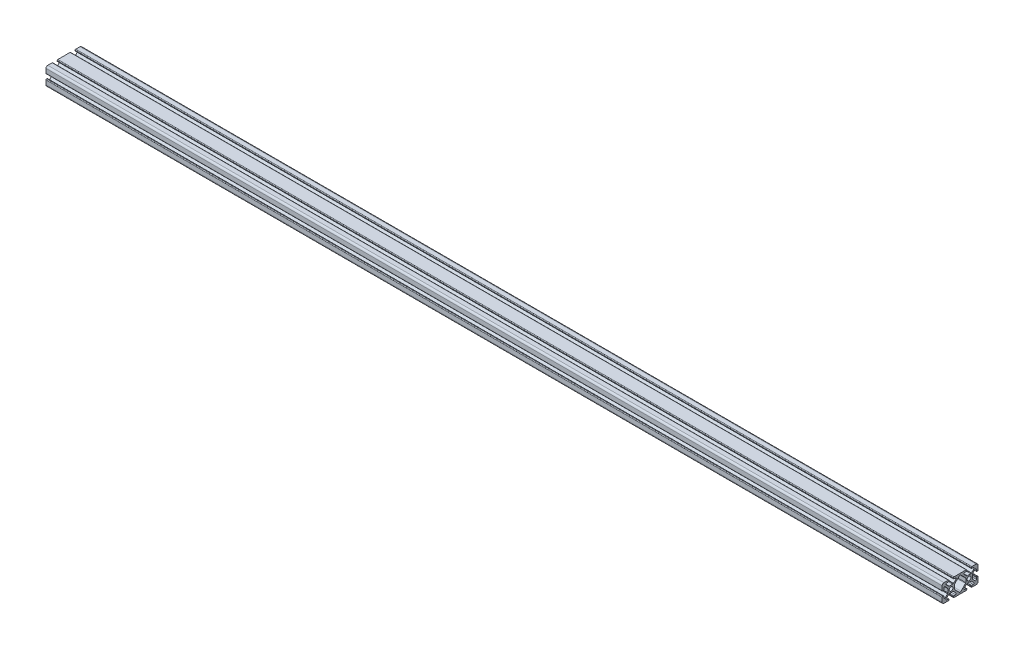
SolidWorks part; units mm, degrees
ref_plane "Ebene vorne" through (0, 0, 0) normal (0, 0, 1) x (1, 0, 0)
ref_plane "Ebene oben" through (0, 0, 0) normal (0, 1, 0) x (1, 0, 0)
ref_plane "Ebene rechts" through (0, 0, 0) normal (1, 0, 0) x (0, 0, -1)
sketch "Skizze1" plane through (0, 0, 0) normal (0, 1, 0) x (1, 0, 0)
  line L0 (0, 0) -> (1000, 0)
  dimension "D1" = 1000
other "Strukturbauteil1"
ref_plane "Ebene1" through (0, 0, 0) normal (1, 0, 0) x (0, 0, -1)
sketch "Model" plane through (0, 0, 0) normal (1, 0, 0) x (0, 0, -1)
  line L0 (-20, -3.2) -> (-20, -8)
  line L1 (-18, -10) -> (-13.2, -10)
  line L2 (-12.5, -9.3) -> (-12.5, -8.7)
  line L3 (-13, -8.2) -> (-14.8676, -8.2)
  line L4 (-15.4915, -6.6936) -> (-12.7408, -3.9429)
  line L5 (-12.0337, -3.65) -> (-7.9663, -3.65)
  line L6 (-7.2592, -3.9429) -> (-4.5085, -6.6936)
  line L7 (-5.1324, -8.2) -> (-7, -8.2)
  line L8 (-7.5, -8.7) -> (-7.5, -9.3)
  line L9 (-6.8, -10) -> (6.8, -10)
  line L10 (7.5, -9.3) -> (7.5, -8.7)
  line L11 (7, -8.2) -> (5.1324, -8.2)
  line L12 (4.5085, -6.6936) -> (7.2592, -3.9429)
  line L13 (7.9663, -3.65) -> (12.0337, -3.65)
  line L14 (12.7408, -3.9429) -> (15.4915, -6.6936)
  line L15 (14.8676, -8.2) -> (13, -8.2)
  line L16 (12.5, -8.7) -> (12.5, -9.3)
  line L17 (13.2, -10) -> (18, -10)
  line L18 (20, -8) -> (20, -3.2)
  line L19 (19.3, -2.5) -> (18.7, -2.5)
  line L20 (18.2, -3) -> (18.2, -4.8676)
  line L21 (16.6936, -5.4915) -> (13.9429, -2.7408)
  line L22 (13.65, -2.0337) -> (13.65, 2.0337)
  line L23 (13.9429, 2.7408) -> (16.6936, 5.4915)
  line L24 (18.2, 4.8676) -> (18.2, 3)
  line L25 (18.7, 2.5) -> (19.3, 2.5)
  line L26 (20, 3.2) -> (20, 8)
  line L27 (18, 10) -> (13.2, 10)
  line L28 (12.5, 9.3) -> (12.5, 8.7)
  line L29 (13, 8.2) -> (14.8676, 8.2)
  line L30 (15.4915, 6.6936) -> (12.7408, 3.9429)
  line L31 (12.0337, 3.65) -> (7.9663, 3.65)
  line L32 (7.2592, 3.9429) -> (4.5085, 6.6936)
  line L33 (5.1324, 8.2) -> (7, 8.2)
  line L34 (7.5, 8.7) -> (7.5, 9.3)
  line L35 (6.8, 10) -> (-6.8, 10)
  line L36 (-7.5, 9.3) -> (-7.5, 8.7)
  line L37 (-7, 8.2) -> (-5.1324, 8.2)
  line L38 (-4.5085, 6.6936) -> (-7.2592, 3.9429)
  line L39 (-7.9663, 3.65) -> (-12.0337, 3.65)
  line L40 (-12.7408, 3.9429) -> (-15.4915, 6.6936)
  line L41 (-14.8676, 8.2) -> (-13, 8.2)
  line L42 (-12.5, 8.7) -> (-12.5, 9.3)
  line L43 (-13.2, 10) -> (-18, 10)
  line L44 (-20, 8) -> (-20, 3.2)
  line L45 (-19.3, 2.5) -> (-18.7, 2.5)
  line L46 (-18.2, 3) -> (-18.2, 4.8676)
  line L47 (-16.6936, 5.4915) -> (-13.9429, 2.7408)
  line L48 (-13.65, 2.0337) -> (-13.65, -2.0337)
  line L49 (-13.9429, -2.7408) -> (-16.6936, -5.4915)
  line L50 (-18.2, -4.8676) -> (-18.2, -3)
  line L51 (-18.7, -2.5) -> (-19.3, -2.5)
  line L52 (-6.35, -2.0337) -> (-6.35, 2.0337)
  line L53 (-6.0571, 2.7408) -> (-1.0207, 7.7772)
  line L54 (1.0207, 7.7772) -> (6.0571, 2.7408)
  line L55 (6.35, 2.0337) -> (6.35, -2.0337)
  line L56 (6.0571, -2.7408) -> (1.0207, -7.7772)
  line L57 (-1.0207, -7.7772) -> (-6.0571, -2.7408)
  line L58 (-12.7408, 3.9429) -> (-12.0337, 3.65)
  line L59 (-20, -10) -> (20, -10) construction
  line L60 (-20, -10) -> (-20, 10) construction
  line L61 (-20, 10) -> (20, 10) construction
  line L62 (20, -10) -> (20, 10) construction
  line L63 (-20, -10) -> (20, 10) construction
  line L64 (-20, 10) -> (20, -10) construction
  line L65 (-7.9663, 3.65) -> (-7.2592, 3.9429)
  line L66 (7.2592, 3.9429) -> (7.9663, 3.65)
  line L67 (12.0337, 3.65) -> (12.7408, 3.9429)
  line L68 (13.9429, 2.7408) -> (13.65, 2.0337)
  line L69 (13.65, -2.0337) -> (13.9429, -2.7408)
  line L70 (12.7408, -3.9429) -> (12.0337, -3.65)
  line L71 (7.9663, -3.65) -> (7.2592, -3.9429)
  line L72 (-7.2592, -3.9429) -> (-7.9663, -3.65)
  line L73 (-12.0337, -3.65) -> (-12.7408, -3.9429)
  line L74 (-13.9429, -2.7408) -> (-13.65, -2.0337)
  line L75 (-13.65, 2.0337) -> (-13.9429, 2.7408)
  circle A0 centre (-10, 0) radius 2.15
  circle A1 centre (10, 0) radius 2.15
  arc A2 (-20, -8) -> (-18, -10) centre (-18, -8) ccw
  arc A3 (-13.2, -10) -> (-12.5, -9.3) centre (-13.2, -9.3) ccw
  arc A4 (-12.5, -8.7) -> (-13, -8.2) centre (-13, -8.7) ccw
  arc A5 (-15.4915, -6.6936) -> (-14.8676, -8.2) centre (-14.8676, -7.3176) ccw
  arc A8 (-5.1324, -8.2) -> (-4.5085, -6.6936) centre (-5.1324, -7.3176) ccw
  arc A9 (-7, -8.2) -> (-7.5, -8.7) centre (-7, -8.7) ccw
  arc A10 (-7.5, -9.3) -> (-6.8, -10) centre (-6.8, -9.3) ccw
  arc A11 (6.8, -10) -> (7.5, -9.3) centre (6.8, -9.3) ccw
  arc A12 (7.5, -8.7) -> (7, -8.2) centre (7, -8.7) ccw
  arc A13 (4.5085, -6.6936) -> (5.1324, -8.2) centre (5.1324, -7.3176) ccw
  arc A16 (14.8676, -8.2) -> (15.4915, -6.6936) centre (14.8676, -7.3176) ccw
  arc A17 (13, -8.2) -> (12.5, -8.7) centre (13, -8.7) ccw
  arc A18 (12.5, -9.3) -> (13.2, -10) centre (13.2, -9.3) ccw
  arc A19 (18, -10) -> (20, -8) centre (18, -8) ccw
  arc A20 (20, -3.2) -> (19.3, -2.5) centre (19.3, -3.2) ccw
  arc A21 (18.7, -2.5) -> (18.2, -3) centre (18.7, -3) ccw
  arc A22 (16.6936, -5.4915) -> (18.2, -4.8676) centre (17.3176, -4.8676) ccw
  arc A25 (18.2, 4.8676) -> (16.6936, 5.4915) centre (17.3176, 4.8676) ccw
  arc A26 (18.2, 3) -> (18.7, 2.5) centre (18.7, 3) ccw
  arc A27 (19.3, 2.5) -> (20, 3.2) centre (19.3, 3.2) ccw
  arc A28 (20, 8) -> (18, 10) centre (18, 8) ccw
  arc A29 (13.2, 10) -> (12.5, 9.3) centre (13.2, 9.3) ccw
  arc A30 (12.5, 8.7) -> (13, 8.2) centre (13, 8.7) ccw
  arc A31 (15.4915, 6.6936) -> (14.8676, 8.2) centre (14.8676, 7.3176) ccw
  arc A34 (5.1324, 8.2) -> (4.5085, 6.6936) centre (5.1324, 7.3176) ccw
  arc A35 (7, 8.2) -> (7.5, 8.7) centre (7, 8.7) ccw
  arc A36 (7.5, 9.3) -> (6.8, 10) centre (6.8, 9.3) ccw
  arc A37 (-6.8, 10) -> (-7.5, 9.3) centre (-6.8, 9.3) ccw
  arc A38 (-7.5, 8.7) -> (-7, 8.2) centre (-7, 8.7) ccw
  arc A39 (-4.5085, 6.6936) -> (-5.1324, 8.2) centre (-5.1324, 7.3176) ccw
  arc A42 (-14.8676, 8.2) -> (-15.4915, 6.6936) centre (-14.8676, 7.3176) ccw
  arc A43 (-13, 8.2) -> (-12.5, 8.7) centre (-13, 8.7) ccw
  arc A44 (-12.5, 9.3) -> (-13.2, 10) centre (-13.2, 9.3) ccw
  arc A45 (-18, 10) -> (-20, 8) centre (-18, 8) ccw
  arc A46 (-20, 3.2) -> (-19.3, 2.5) centre (-19.3, 3.2) ccw
  arc A47 (-18.7, 2.5) -> (-18.2, 3) centre (-18.7, 3) ccw
  arc A48 (-16.6936, 5.4915) -> (-18.2, 4.8676) centre (-17.3176, 4.8676) ccw
  arc A51 (-18.2, -4.8676) -> (-16.6936, -5.4915) centre (-17.3176, -4.8676) ccw
  arc A52 (-18.2, -3) -> (-18.7, -2.5) centre (-18.7, -3) ccw
  arc A53 (-19.3, -2.5) -> (-20, -3.2) centre (-19.3, -3.2) ccw
  arc A54 (-6.35, -2.0337) -> (-6.0571, -2.7408) centre (-5.35, -2.0337) ccw
  arc A55 (-6.0571, 2.7408) -> (-6.35, 2.0337) centre (-5.35, 2.0337) ccw
  arc A56 (1.0207, 7.7772) -> (-1.0207, 7.7772) centre (0, 6.7565) ccw
  arc A57 (6.35, 2.0337) -> (6.0571, 2.7408) centre (5.35, 2.0337) ccw
  arc A58 (6.0571, -2.7408) -> (6.35, -2.0337) centre (5.35, -2.0337) ccw
  arc A59 (-1.0207, -7.7772) -> (1.0207, -7.7772) centre (0, -6.7565) ccw
  point P16 (0, 0)
  point P178 (0, 0)
  point P184 (-20, 0)
  point P185 (-10, 10)
  point P186 (-10, -10)
  point P187 (10, -10)
  point P188 (20, -0.5508)
  point P189 (10, 10)
